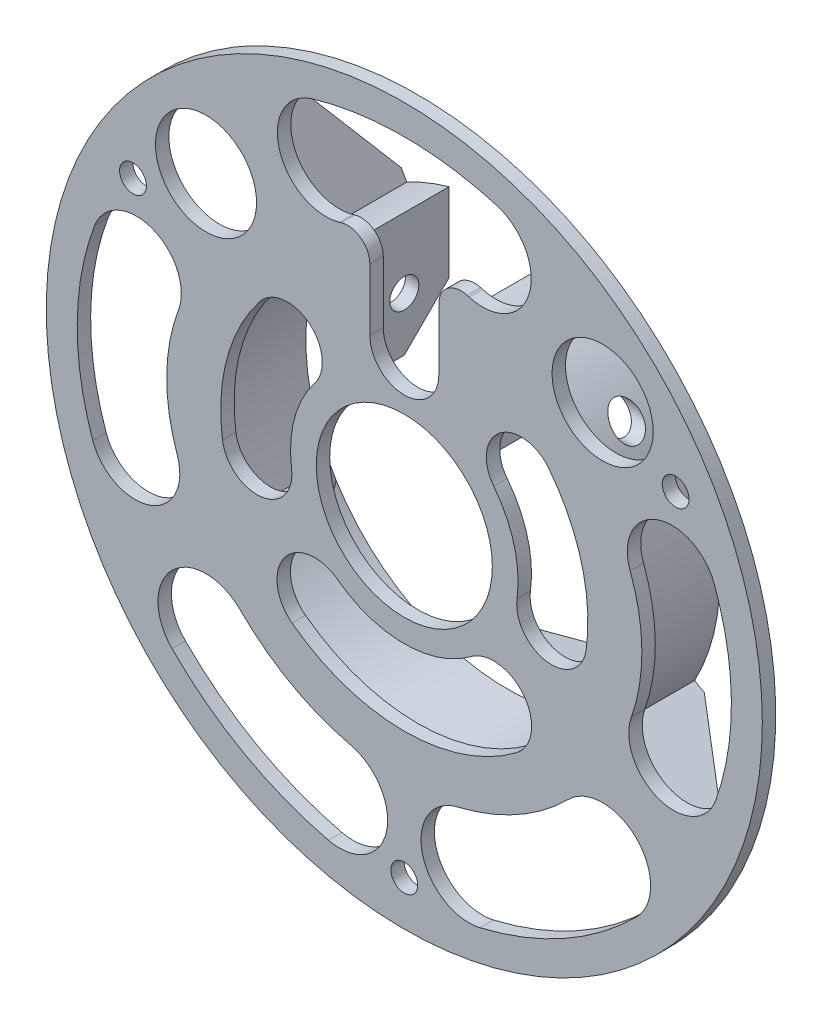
SolidWorks part; units mm, degrees
ref_plane "Plan de face" through (0, 0, 0) normal (0, 0, 1) x (1, 0, 0)
ref_plane "Plan de dessus" through (0, 0, 0) normal (0, 1, 0) x (1, 0, 0)
ref_plane "Plan de droite" through (0, 0, 0) normal (1, 0, 0) x (0, 0, -1)
sketch "Esquisse1" plane through (0, 0, 0) normal (0, 0, 1) x (1, 0, 0)
  circle A0 centre (0, 0) radius 47.5
  circle A1 centre (0, 0) radius 45
  dimension "D1" = 95
  dimension "D2" = 90
extrude "Boss.-Extru.1" add sketch "Esquisse1" along normal blind 20
sketch "Esquisse2" plane through (0, 0, 20) normal (0, 0, 1) x (1, 0, 0)
  circle A0 centre (0, 0) radius 80
  dimension "D1" = 160
extrude "Boss.-Extru.2" add sketch "Esquisse2" along normal blind 3
sketch "Esquisse3" plane through (0, 0, 20) normal (0, 0, -1) x (-1, 0, 0)
  line L0 (0, 0) -> (69.282, 40) construction
  line L1 (0, 0) -> (0, 80) construction
  circle A0 centre (0, 0) radius 80 construction
  circle A1 centre (60.6218, 35) radius 3
  dimension "D1" = 6
  dimension "D2" = 70
  dimension "D3" = 60
extrude "Enlèv. mat.-Extru.2" cut sketch "Esquisse3" against normal blind 3
pattern_circular "Répétition circulaire1" count 3 over 360 about axis through (0, 0, 0) along (0, 0, 1) of "Enlèv. mat.-Extru.2"
sketch "Esquisse4" plane through (0, 0, 20) normal (0, 0, -1) x (-1, 0, 0)
  line L0 (0, 0) -> (0, 62.5) construction
  line L1 (0, 0) -> (0, -70) construction
  line L2 (0, 0) -> (83.3652, 0) construction
  circle A0 centre (0, 0) radius 62.5 construction
  arc A1 (47.1726, 41) -> (47.1726, -41) centre (0, 0) cw construction
  arc A2 (54.7202, -47.56) -> (54.7202, 47.56) centre (0, 0) ccw
  arc A3 (39.6249, -34.44) -> (39.6249, 34.44) centre (0, 0) ccw
  arc A4 (39.6249, -34.44) -> (54.7202, -47.56) centre (47.1726, -41) ccw
  arc A5 (54.7202, 47.56) -> (39.6249, 34.44) centre (47.1726, 41) ccw
  point P11 (62.5, 0)
  dimension "D1" = 125
  dimension "D2" = 20
  dimension "D3" = 82
sketch "Esquisse5" plane through (0, 0, 20) normal (0, 0, -1) x (-1, 0, 0)
  line L0 (0, 0) -> (0, 70) construction
  line L2 (-13, 55.2993) -> (13, 55.2993)
  line L3 (-13, 55.2993) -> (-13, 35.9982)
  line L4 (-13, 35.9982) -> (13, 35.9982)
  line L5 (13, 55.2993) -> (13, 35.9982)
  dimension "D1" = 26
extrude "Enlèv. mat.-Extru.4" cut sketch "Esquisse5" along normal blind 57
sketch "Esquisse6" plane through (0, 0, 20) normal (0, 0, -1) x (-1, 0, 0)
  line L0 (0, 47.0037) -> (0, 28.2981) construction
  line L1 (-13, 43.0813) -> (-16, 43.0813)
  line L2 (-13, 43.0813) -> (-13, 18.0813)
  line L3 (-13, 18.0813) -> (-16, 18.0813)
  line L4 (-16, 43.0813) -> (-16, 18.0813)
  line L5 (16, 43.0813) -> (16, 18.0813)
  line L6 (13, 18.0813) -> (16, 18.0813)
  line L7 (13, 43.0813) -> (13, 18.0813)
  line L8 (13, 43.0813) -> (16, 43.0813)
  dimension "D1" = 3
  dimension "D2" = 25
extrude "Boss.-Extru.3" add sketch "Esquisse6" along normal blind 20
sketch "Esquisse7" plane through (-16, 0, 0) normal (-1, 0, 0) x (0, 0, 1)
  line L4 (50.7915, 0) -> (-69.2194, 0) construction
  point P8 (12.3348, 0)
  point P13 (-2.6652, 0)
  dimension "D1" = 15
sketch "Esquisse8" plane through (-16, 0, 0) normal (-1, 0, 0) x (0, 0, 1)
  line L0 (0, 30.0704) -> (18.0118, 30.0704) construction
  line L1 (0, 18.0813) -> (0, 42.0595) construction
  line L3 (20, 80) -> (20, -80) construction
  circle A0 centre (10, 30.0704) radius 3.25
  dimension "D1" = 6.5
  dimension "D2" = 10
extrude "Enlèv. mat.-Extru.5" cut sketch "Esquisse8" against normal through all
sketch "Esquisse9" plane through (0, 0, 20) normal (0, 0, -1) x (-1, 0, 0)
  line L0 (0, 0) -> (-69.282, -40) construction
  line L1 (-20.879, -13.7865) -> (-22.379, -11.1885)
  line L2 (-22.379, -11.1885) -> (-39.6995, -21.1885)
  line L3 (-20.879, -13.7865) -> (-38.1995, -23.7865)
  line L4 (0, 0) -> (0, -35) construction
  line L5 (20.879, -13.7865) -> (38.1995, -23.7865)
  line L6 (22.379, -11.1885) -> (39.6995, -21.1885)
  line L7 (20.879, -13.7865) -> (22.379, -11.1885)
  line L8 (0, 0) -> (0, -70) construction
  arc A0 (-16, 42.0595) -> (16, 42.0595) centre (0, 0) ccw construction
  arc A1 (-39.6995, -21.1885) -> (-38.1995, -23.7865) centre (0, 0) ccw
  arc A2 (39.6995, -21.1885) -> (38.1995, -23.7865) centre (0, 0) cw
  circle A3 centre (0, 0) radius 80 construction
  point P8 (-21.629, -12.4875)
  point P14 (21.629, -12.4875)
  dimension "D1" = 3
  dimension "D2" = 20
  dimension "D3" = 60
extrude "Boss.-Extru.4" add sketch "Esquisse9" along normal blind 20
chamfer "Chanfrein1" distance 20 angle 45 2 edges at (-21.629, -12.4875, 0) (21.629, -12.4875, 0)
chamfer "Chanfrein3" distance 10 angle 45 2 edges at (-14.5, 18.0813, 0) (14.5, 18.0813, 0)
sketch "Esquisse10" plane through (0, 0, 20) normal (0, 0, -1) x (-1, 0, 0)
  line L0 (0, 0) -> (0, 44.892) construction
  line L1 (0, 31.0717) -> (0, 55.9777) construction
  line L2 (-7.7006, 31.0717) -> (-7.7006, 55.9777)
  line L3 (7.7006, 31.0717) -> (7.7006, 55.9777)
  arc A0 (32.9128, -4.564) -> (26.1236, 20.5339) centre (0, 0) ccw construction
  circle A1 centre (0, 0) radius 33.2277 construction
  arc A2 (-32.9128, -4.564) -> (-26.1236, 20.5339) centre (0, 0) cw construction
  arc A3 (-32.2552, 25.3535) -> (-40.638, -5.6353) centre (0, 0) ccw
  arc A4 (-19.9919, 15.7143) -> (-25.1876, -3.4928) centre (0, 0) ccw
  arc A5 (-19.9919, 15.7143) -> (-32.2552, 25.3535) centre (-26.1236, 20.5339) ccw
  arc A6 (-40.638, -5.6353) -> (-25.1876, -3.4928) centre (-32.9128, -4.564) ccw
  arc A7 (32.2552, 25.3535) -> (40.638, -5.6353) centre (0, 0) cw
  arc A8 (19.9919, 15.7143) -> (25.1876, -3.4928) centre (0, 0) cw
  arc A9 (19.9919, 15.7143) -> (32.2552, 25.3535) centre (26.1236, 20.5339) cw
  arc A10 (40.638, -5.6353) -> (25.1876, -3.4928) centre (32.9128, -4.564) cw
  arc A11 (-19.9919, -26.5406) -> (19.9919, -26.5406) centre (0, 0) ccw construction
  arc A12 (-25.0803, -33.2958) -> (25.0803, -33.2958) centre (0, 0) ccw
  arc A13 (-14.9035, -19.7854) -> (14.9035, -19.7854) centre (0, 0) ccw
  arc A14 (-14.9035, -19.7854) -> (-25.0803, -33.2958) centre (-19.9919, -26.5406) ccw
  arc A15 (25.0803, -33.2958) -> (14.9035, -19.7854) centre (19.9919, -26.5406) ccw
  circle A16 centre (0, 0) radius 19.6695
  arc A17 (-7.7006, 31.0717) -> (7.7006, 31.0717) centre (0, 31.0717) ccw
  arc A18 (7.7006, 55.9777) -> (-7.7006, 55.9777) centre (0, 55.9777) ccw
  point P7 (-32.0749, 8.6765)
  point P14 (32.0749, 8.6765)
  point P22 (0, -33.2277)
  point P30 (0, 43.5247)
  dimension "D1" = 26
extrude "Enlèv. mat.-Extru.6" cut sketch "Esquisse10" against normal blind 20
sketch "Esquisse11" plane through (0, 0, 20) normal (0, 0, -1) x (-1, 0, 0)
  line L0 (0, 0) -> (-48.1792, 83.4488) construction
  line L2 (0, 0) -> (0, 62.5) construction
  line L3 (-41.292, 68.5199) -> (-25.0372, 40.3657)
  line L4 (-38.6939, 70.0199) -> (-22.4391, 41.8657)
  line L5 (0, 0) -> (0, 87.6009) construction
  line L6 (0, 0) -> (48.1792, 83.4488) construction
  line L7 (38.6939, 70.0199) -> (22.4391, 41.8657)
  line L8 (41.292, 68.5199) -> (25.0372, 40.3657)
  line L9 (-41.8657, -22.4391) -> (-70.0199, -38.6939)
  line L10 (-39.6995, -21.1885) -> (-22.379, -11.1885) construction
  line L11 (-40.3657, -25.0372) -> (-68.5199, -41.292)
  line L12 (-38.1995, -23.7865) -> (-20.879, -13.7865) construction
  line L13 (40.3657, -25.0372) -> (68.5199, -41.292)
  line L14 (41.8657, -22.4391) -> (70.0199, -38.6939)
  circle A0 centre (0, 0) radius 80 construction
  arc A1 (-13, 45.6864) -> (13, 45.6864) centre (0, 0) ccw construction
  arc A2 (-38.6939, 70.0199) -> (-41.292, 68.5199) centre (0, 0) ccw
  arc A3 (-22.4391, 41.8657) -> (-25.0372, 40.3657) centre (0, 0) ccw
  arc A4 (22.4391, 41.8657) -> (25.0372, 40.3657) centre (0, 0) cw
  arc A5 (38.6939, 70.0199) -> (41.292, 68.5199) centre (0, 0) cw
  arc A6 (-70.0199, -38.6939) -> (-68.5199, -41.292) centre (0, 0) ccw
  arc A7 (41.292, 68.5199) -> (-41.292, 68.5199) centre (0, 0) ccw
  arc A8 (70.0199, -38.6939) -> (68.5199, -41.292) centre (0, 0) cw
  arc A9 (-13, 45.6864) -> (-25.0372, 40.3657) centre (0, 0) ccw
  arc A10 (-41.8657, -22.4391) -> (-40.3657, -25.0372) centre (0, 0) ccw
  arc A11 (40.3657, -25.0372) -> (41.8657, -22.4391) centre (0, 0) ccw
  arc A12 (25.0372, 40.3657) -> (13, 45.6864) centre (0, 0) ccw
  dimension "D1" = 30
  dimension "D2" = 3
extrude "Boss.-Extru.5" add sketch "Esquisse11" along normal blind 20 contours L11 L9 M27 M18 | L8 L7 M18 M27 | L4 L3 M18 M27 | L14 A8 L13 A11
chamfer "Chanfrein4" distance 20 distance2 30 4 edges at (40, 69.282, 0) (-40, 69.282, 0) (-69.282, -40, 0) (69.282, -40, 0)
sketch "Esquisse12" plane through (0, 0, 20) normal (0, 0, -1) x (-1, 0, 0)
  line L0 (0, 0) -> (0, 62.5) construction
  line L1 (0, 0) -> (0, 62.5) construction
  arc A0 (-59.831, 18.0693) -> (-60.1636, -16.9291) centre (-11.9084, 0.1132) ccw construction
  circle A1 centre (0, 0) radius 62.5 construction
  arc A2 (-69.196, 21.5783) -> (-69.5936, -20.2595) centre (-11.9084, 0.1132) ccw
  arc A3 (-50.466, 14.5603) -> (-50.7335, -13.5987) centre (-11.9084, 0.1132) ccw
  arc A4 (-50.466, 14.5603) -> (-69.196, 21.5783) centre (-59.831, 18.0693) ccw
  arc A5 (-69.5936, -20.2595) -> (-50.7335, -13.5987) centre (-60.1636, -16.9291) ccw
  circle A6 centre (-44.3071, 44.0809) radius 11.2957
  arc A7 (-17.5, 60) -> (17.5, 60) centre (0, 0) cw construction
  arc A8 (20.5405, 70.4247) -> (-20.5405, 70.4247) centre (0, 0) ccw
  arc A9 (14.4595, 49.5753) -> (-14.4595, 49.5753) centre (0, 0) ccw
  arc A10 (14.4595, 49.5753) -> (20.5405, 70.4247) centre (17.5, 60) ccw
  arc A11 (-20.5405, 70.4247) -> (-14.4595, 49.5753) centre (-17.5, 60) ccw
  arc A12 (59.831, 18.0693) -> (60.1636, -16.9291) centre (11.9084, 0.1132) cw construction
  arc A13 (69.196, 21.5783) -> (69.5936, -20.2595) centre (11.9084, 0.1132) cw
  arc A14 (50.466, 14.5603) -> (50.7335, -13.5987) centre (11.9084, 0.1132) cw
  arc A15 (50.466, 14.5603) -> (69.196, 21.5783) centre (59.831, 18.0693) cw
  arc A16 (69.5936, -20.2595) -> (50.7335, -13.5987) centre (60.1636, -16.9291) cw
  circle A17 centre (44.3071, 44.0809) radius 11.2957
  arc A18 (-44.3071, -44.0809) -> (-14.4595, -60.8044) centre (0, 0) ccw construction
  arc A19 (-51.9137, -51.6487) -> (-16.9418, -71.2432) centre (0, 0) ccw
  arc A20 (-36.7006, -36.5132) -> (-11.9771, -50.3656) centre (0, 0) ccw
  arc A21 (-36.7006, -36.5132) -> (-51.9137, -51.6487) centre (-44.3071, -44.0809) ccw
  arc A22 (-16.9418, -71.2432) -> (-11.9771, -50.3656) centre (-14.4595, -60.8044) ccw
  arc A23 (44.3071, -44.0809) -> (14.4595, -60.8044) centre (0, 0) cw construction
  arc A24 (51.9137, -51.6487) -> (16.9418, -71.2432) centre (0, 0) cw
  arc A25 (36.7006, -36.5132) -> (11.9771, -50.3656) centre (0, 0) cw
  arc A26 (36.7006, -36.5132) -> (51.9137, -51.6487) centre (44.3071, -44.0809) cw
  arc A27 (16.9418, -71.2432) -> (11.9771, -50.3656) centre (14.4595, -60.8044) cw
  point P3 (-63.0823, 0.5994)
  point P12 (0, 62.5)
  point P25 (63.0823, 0.5994)
  point P35 (-30.5499, -54.5248)
  point P42 (30.5499, -54.5248)
  dimension "D1" = 35
  dimension "D2" = 35
extrude "Enlèv. mat.-Extru.7" cut sketch "Esquisse12" against normal blind 20
fillet "Congé1" radius 5 2 edges at (7.7006, 51.0636, 21.5) (-7.7006, 51.0636, 21.5)
